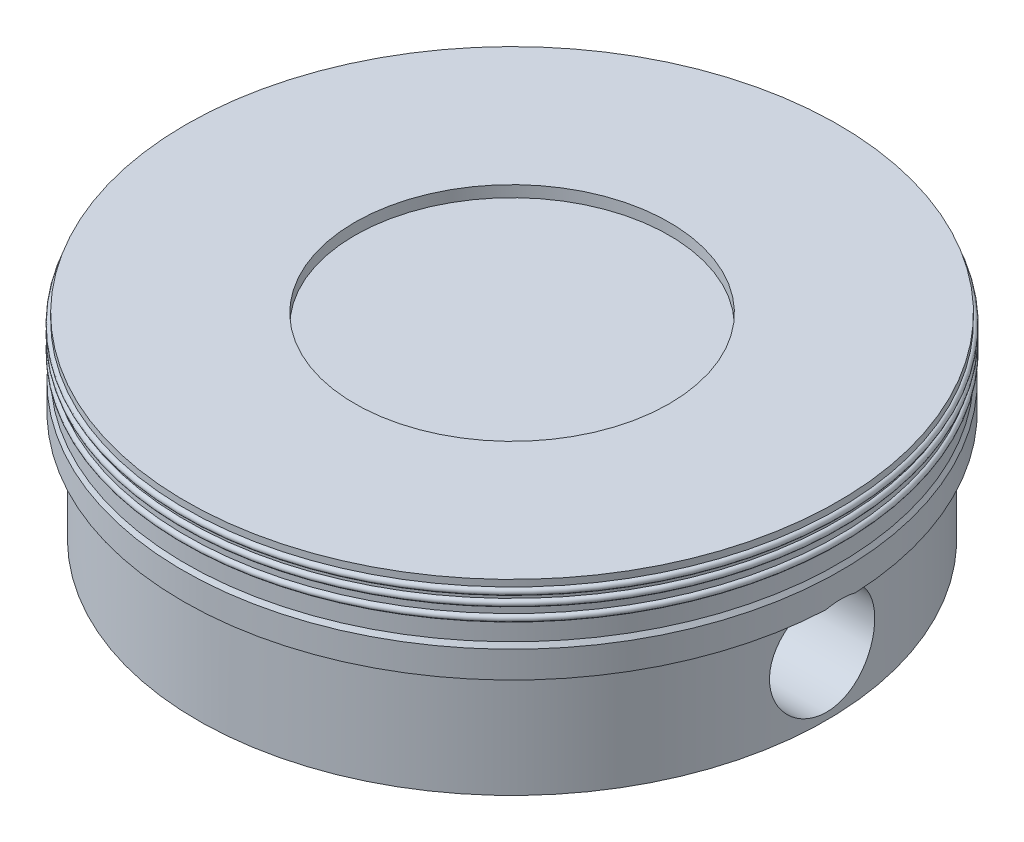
SolidWorks part; units mm, degrees
ref_plane "正面" through (0, 0, 0) normal (0, 0, 1) x (1, 0, 0)
ref_plane "平面" through (0, 0, 0) normal (0, 1, 0) x (1, 0, 0)
ref_plane "右側面" through (0, 0, 0) normal (1, 0, 0) x (0, 0, -1)
sketch "ｽｹｯﾁ1" plane through (0, 0, 0) normal (0, 0, 1) x (1, 0, 0)
  line L0 (0, 3) -> (0, 0) construction
  line L1 (0, 0) -> (5, 0) construction
  line L2 (4.78, 0) -> (3.43, 0)
  line L3 (3.43, 0) -> (3.43, 1.93)
  line L4 (3.43, 1.93) -> (4.2, 1.93)
  line L5 (4.2, 1.93) -> (4.2, 2.33)
  line L6 (4.2, 2.33) -> (0, 2.33)
  line L7 (0, 2.33) -> (0, 2.8)
  line L8 (0, 2.8) -> (2.39, 2.8)
  line L9 (2.39, 2.8) -> (2.39, 2.972)
  line L10 (2.39, 2.972) -> (4.96, 2.972)
  line L11 (4.96, 2.972) -> (4.96, 2.872)
  line L12 (4.96, 2.1507) -> (5, 2.0807)
  line L13 (5, 2.0807) -> (5, 1.675)
  line L14 (5, 1.675) -> (4.78, 1.675)
  line L15 (4.78, 1.675) -> (4.78, 0)
  line L16 (4.96, 2.772) -> (4.96, 2.722)
  line L17 (4.96, 2.622) -> (4.96, 2.522)
  line L18 (4.96, 2.422) -> (4.96, 2.1507)
  arc A0 (4.96, 2.772) -> (4.96, 2.872) centre (4.96, 2.822) ccw
  arc A2 (4.96, 2.422) -> (4.96, 2.522) centre (4.96, 2.472) ccw
  arc A3 (4.96, 2.622) -> (4.96, 2.722) centre (4.96, 2.672) ccw
  point P25 (4.96, 2.1272)
  dimension "D20" = 0.05
  dimension "D21" = 0.05
  dimension "D22" = 0.05
  dimension "D1" = 5
  dimension "D2" = 3
  dimension "D3" = 4.96
  dimension "D4" = 0.04
  dimension "D5" = 5
  dimension "D6" = 0.22
  dimension "D7" = 1.675
  dimension "D8" = 1.35
  dimension "D9" = 1.93
  dimension "D10" = 0.4
  dimension "D11" = 2.57
  dimension "D12" = 0.172
  dimension "D13" = 0.47
  dimension "D14" = 4.2
  dimension "D15" = 0.15
  dimension "D16" = 0.2
  dimension "D17" = 0.15
  dimension "D18" = 0.4057
  dimension "D19" = 0.07
revolve "回転1" add sketch "ｽｹｯﾁ1" angle 360 about L0
sketch "ｽｹｯﾁ3" plane through (0, 0, 0) normal (0, -1, 0) x (1, 0, 0)
  line L0 (0, 3.43) -> (0, 0) construction
  line L1 (0, 0) -> (-3.43, 0) construction
  line L2 (-1.75, 2.95) -> (-1.75, -2.95)
  line L3 (1.75, 2.95) -> (1.75, -2.95)
  circle A0 centre (0, 0) radius 3.43 construction
  arc A1 (-1.75, 2.95) -> (-1.75, -2.95) centre (0, 0) ccw
  arc A2 (1.75, -2.95) -> (1.75, 2.95) centre (0, 0) ccw
  dimension "D1" = 3.5
extrude "ﾎﾞｽ - 押し出し1" add sketch "ｽｹｯﾁ3" against normal up to next
sketch "ｽｹｯﾁ4" plane through (0, 0, 0) normal (1, 0, 0) x (0, 0, -1)
  line L0 (-4.78, 0) -> (4.78, 0) construction
  circle A0 centre (0, 0.9065) radius 0.8
  point P4 (0, 0)
  dimension "D1" = 1.6
  dimension "D2" = 0.9065
extrude "ｶｯﾄ - 押し出し1" cut sketch "ｽｹｯﾁ4" against normal through all both and the other way through all
